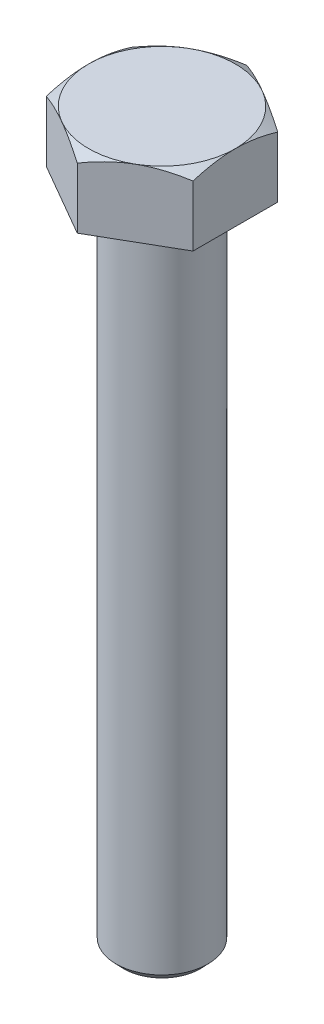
SolidWorks part; units mm, degrees
ref_plane "Front" through (0, 0, 0) normal (0, 0, 1) x (1, 0, 0)
ref_plane "Top" through (0, 0, 0) normal (0, 1, 0) x (1, 0, 0)
ref_plane "Right" through (0, 0, 0) normal (1, 0, 0) x (0, 0, -1)
sketch "Sketch1" plane through (0, 0, 0) normal (0, 0, 1) x (1, 0, 0)
  line L0 (0, 0) -> (8, 0)
  line L1 (8, 0) -> (8, 4.85)
  line L2 (8, 4.85) -> (6.35, 5.842)
  line L3 (6.35, 5.842) -> (0, 5.842)
  line L4 (0, 5.842) -> (0, 0)
  line L5 (0, 0) -> (0, 13.4364) construction
  dimension "D1" = 8
  dimension "D2" = 5.842
revolve "Base-Revolve" add sketch "Sketch1" angle 360 about L5
sketch "Sketch2" plane through (0, 0, 0) normal (0, 0, 1) x (1, 0, 0)
  line L0 (0, 0) -> (0, 100) construction
  line L1 (0, -57.15) -> (3.3095, -57.15)
  line L2 (3.3095, -57.15) -> (3.9688, -56.4595)
  line L3 (3.9688, -56.4595) -> (3.9687, 0)
  line L4 (3.9687, 0) -> (0, 0)
  line L5 (0, 0) -> (0, -57.15)
  dimension "D1" = 57.15
  dimension "D2" = 3.9688
revolve "Boss-Revolve1" add sketch "Sketch2"
ref_plane "Plane4" through (0, 8, 0) normal (0, 1, 0) x (-1, 0, 0)
sketch "Sketch3" plane through (0, 8, 0) normal (0, 1, 0) x (-1, 0, 0)
  line L0 (6.35, 3.6662) -> (0, 7.3323)
  line L1 (0, 7.3323) -> (-6.35, 3.6662)
  line L2 (-6.35, 3.6662) -> (-6.35, -3.6662)
  line L3 (-6.35, -3.6662) -> (0, -7.3323)
  line L4 (0, -7.3323) -> (6.35, -3.6662)
  line L5 (6.35, -3.6662) -> (6.35, 3.6662)
  point P6 (6.35, 0)
  dimension "D1" = 120
  dimension "D2" = 12.7
  dimension "D3" = 120
extrude "Cut-Extrude1" cut sketch "Sketch3" against normal through all flip side to cut
